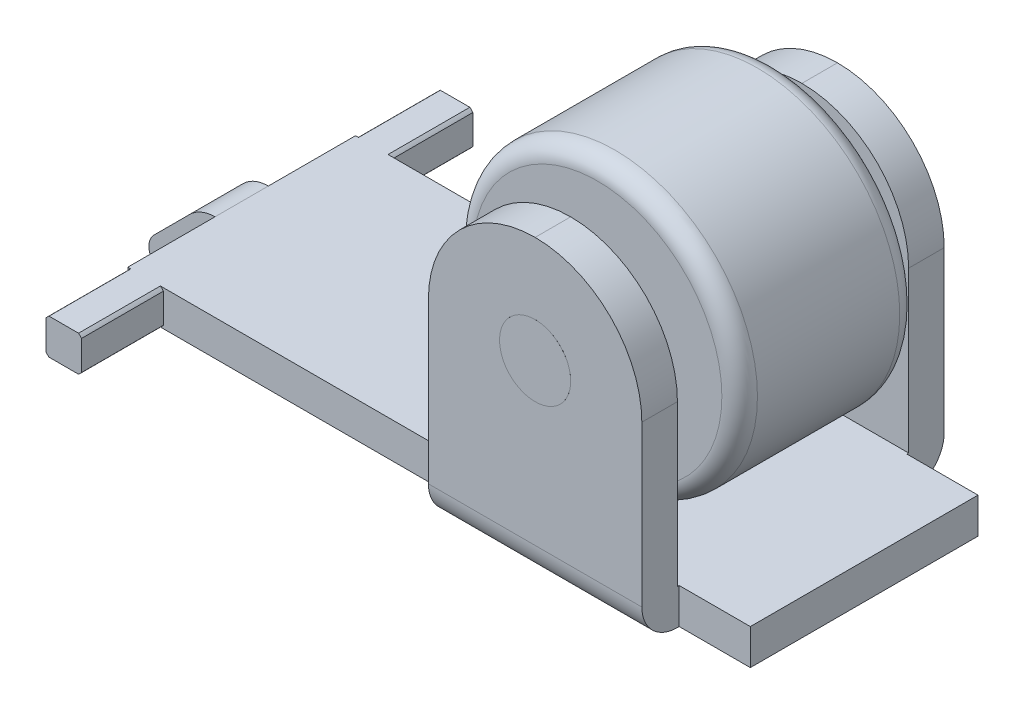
SolidWorks part; units mm, degrees
ref_plane "Plan de face" through (0, 0, 0) normal (0, 0, 1) x (1, 0, 0)
ref_plane "Plan de dessus" through (0, 0, 0) normal (0, 1, 0) x (1, 0, 0)
ref_plane "Plan de droite" through (0, 0, 0) normal (1, 0, 0) x (0, 0, -1)
sketch "Esquisse1" plane through (0, 0, 0) normal (0, 0, 1) x (1, 0, 0)
  line L0 (0, 0) -> (17, 0) construction
  line L1 (17, 0.5) -> (17, -0.5)
  line L3 (0, -0.5) -> (17, -0.5)
  line L6 (0, 0.5) -> (17, 0.5)
  line L10 (0, -0.5) -> (17, -0.5) construction
  line L11 (0, 0.5) -> (-0.5, 0.5)
  line L12 (-0.5, 0.5) -> (-0.5, -0.5)
  line L13 (-0.5, -0.5) -> (0, -0.5)
  line L14 (0.5, 0.5) -> (0.5, -0.5) construction
  line L15 (17, 0.5) -> (24.5527, 0.5) construction
  line L16 (17, 0) -> (24.6299, 0) construction
  line L17 (17, -0.5) -> (24.7071, -0.5) construction
  line L18 (24.5527, 0.5) -> (48.1211, 7.9535) construction
  line L19 (24.7071, -0.5) -> (48.4226, 7) construction
  line L20 (24.6299, 0) -> (48.2719, 7.4767) construction
  arc A0 (0, 0.5) -> (0, -0.5) centre (0, 0) ccw construction
  circle A1 centre (0, 0) radius 0.65 construction
  dimension "D7" = 1.3
  dimension "D1" = 17
  dimension "D5" = 0.5
  dimension "D6" = 0.5
extrude "Boss.-Extru.1" add sketch "Esquisse1" along normal mid plane 6.4
sketch "Esquisse2" plane through (0, 0, 0) normal (0, 0, 1) x (1, 0, 0)
  line L0 (-0.5, 0.5) -> (-0.5, -0.5) construction
  line L1 (0.5, 0.5) -> (0.5, -0.5) construction
  line L2 (-0.5, 0.5) -> (-0.5, -0.5)
  line L3 (0.5, 0.5) -> (0.5, -0.5)
  line L4 (-0.5, 0.5) -> (0.5, 0.5)
  line L5 (-0.5, -0.5) -> (0.5, -0.5)
extrude "Boss.-Extru.2" add sketch "Esquisse2" along normal mid plane 11
sketch "Esquisse3" plane through (0, 0, 5.5) normal (0, 0, 1) x (1, 0, 0)
  circle A0 centre (0, 0) radius 0.65
  dimension "D1" = 1.3
extrude "Enlèv. mat.-Extru.1" cut sketch "Esquisse3" against normal up to surface (2.3 mm away) flip side to cut
sketch "Esquisse4" plane through (0, 0, -5.5) normal (0, 0, -1) x (-1, 0, 0)
  circle A0 centre (0, 0) radius 0.65 construction
  circle A1 centre (0, 0) radius 0.65
extrude "Enlèv. mat.-Extru.2" cut sketch "Esquisse4" against normal up to surface (2.3 mm away) flip side to cut
sketch "Esquisse5" plane through (0, 0, 0) normal (0, 0, 1) x (1, 0, 0)
  line L0 (-0.5, 0.5) -> (-0.4153, 0.5) construction
  line L1 (-0.5, 0.4153) -> (-0.5, 0.5) construction
  line L2 (-0.5, -0.5) -> (-0.5, -0.4153) construction
  line L3 (-0.4153, -0.5) -> (-0.5, -0.5) construction
  line L4 (-0.5, 0.5) -> (-0.4153, 0.5)
  line L5 (-0.5, 0.4153) -> (-0.5, 0.5)
  line L6 (-0.5, -0.5) -> (-0.5, -0.4153)
  line L7 (-0.4153, -0.5) -> (-0.5, -0.5)
  arc A0 (-0.4153, 0.5) -> (-0.5, 0.4153) centre (0, 0) ccw construction
  arc A1 (-0.5, -0.4153) -> (-0.4153, -0.5) centre (0, 0) ccw construction
  arc A2 (-0.4153, 0.5) -> (-0.5, 0.4153) centre (0, 0) ccw
  arc A3 (-0.5, -0.4153) -> (-0.4153, -0.5) centre (0, 0) ccw
sketch "Esquisse6" plane through (0, 0, 0) normal (0, 0, 1) x (1, 0, 0)
  line L0 (-0.5, -0.5) -> (-1.5036, -1.5036)
  line L1 (0, 0) -> (17, 0) construction
  line L2 (-2.2107, -0.7964) -> (-1.2071, 0.2071)
  line L4 (0, -0.5) -> (17, -0.5) construction
  line L7 (-0.5, 0.5) -> (-0.5, -0.5) construction
  line L8 (-0.5, 0.5) -> (-0.5, -0.5)
  line L9 (-1.8571, -1.15) -> (-2.2107, -1.5036) construction
  arc A0 (-0.5, 0.5) -> (-1.2071, 0.2071) centre (-0.5, -0.5) ccw
  arc A1 (-2.2107, -0.7964) -> (-1.5036, -1.5036) centre (-1.8571, -1.15) ccw
  point P1 (-1.9768, -1.9768)
  point P4 (-2.6839, -1.2697)
  dimension "D1" = 135
  dimension "D2" = 1.15
extrude "Boss.-Extru.3" add sketch "Esquisse6" along normal mid plane 1.5
ref_plane "Plan1" through (15, 0, 0) normal (1, 0, 0) x (0, 0, -1)
sketch "Esquisse7" plane through (15, 0, 0) normal (1, 0, 0) x (0, 0, -1)
  line L2 (-3.2, 0.5) -> (-3.2, -0.5)
  line L3 (3.2, 0.5) -> (3.2, -0.5)
  line L4 (3.2, 0.5) -> (3.25, 0.5)
  line L5 (3.25, 0.5) -> (3.25, 8)
  line L6 (3.25, 8) -> (4.25, 8)
  line L7 (4.25, 8) -> (4.25, 0.5)
  line L8 (3.25, -0.5) -> (3.2, -0.5)
  line L9 (0, 7) -> (0, 9.9912) construction
  line L10 (-3.2, 0.5) -> (-3.25, 0.5)
  line L11 (-3.25, -0.5) -> (-3.2, -0.5)
  line L12 (-4.25, 8) -> (-4.25, 0.5)
  line L13 (-3.25, 8) -> (-4.25, 8)
  line L14 (-3.25, 0.5) -> (-3.25, 8)
  arc A0 (4.25, 0.5) -> (3.25, -0.5) centre (3.25, 0.5) cw
  arc A1 (-4.25, 0.5) -> (-3.25, -0.5) centre (-3.25, 0.5) ccw
  dimension "D1" = 1
  dimension "D2" = 1
  dimension "D3" = 6.5
  dimension "D4" = 7.5
extrude "Boss.-Extru.4" add sketch "Esquisse7" against normal blind 6
sketch "Esquisse8" plane through (0, 0, -4.25) normal (0, 0, -1) x (-1, 0, 0)
  line L0 (-15, 0.5) -> (-15, 8) construction
  line L1 (-9, 0.5) -> (-9, 8) construction
  line L2 (-9, 8) -> (-15, 8) construction
  arc A0 (-14.8951, 5.7863) -> (-14.9257, 5.6638) centre (-12, 5) ccw construction
  circle A1 centre (-12, 5) radius 1
  dimension "D1" = 2
extrude "Enlèv. mat.-Extru.4" cut sketch "Esquisse8" against normal through all
fillet "Congé2" radius 3 4 edges at (9, 8, 3.75) (9, 8, -3.75) (15, 8, 3.75) (15, 8, -3.75)
sketch "Esquisse9" plane through (0, 0, -4.25) normal (0, 0, -1) x (-1, 0, 0)
  circle A0 centre (-12, 5) radius 1 construction
  circle A1 centre (-12, 5) radius 1
extrude "Boss.-Extru.5" add sketch "Esquisse9" against normal up to surface (8.5 mm away) separate body
sketch "Esquisse10" plane through (0, 0, 0) normal (0, 0, 1) x (1, 0, 0)
  circle A0 centre (12, 5) radius 4
  circle A1 centre (12, 5) radius 1 construction
  circle A2 centre (12, 5) radius 1
  dimension "D1" = 8
extrude "Boss.-Extru.7" add sketch "Esquisse10" along normal mid plane 5 separate body
fillet "Congé3" radius 0.5 2 edges at (16, 5, 2.5) (16, 5, -2.5)
